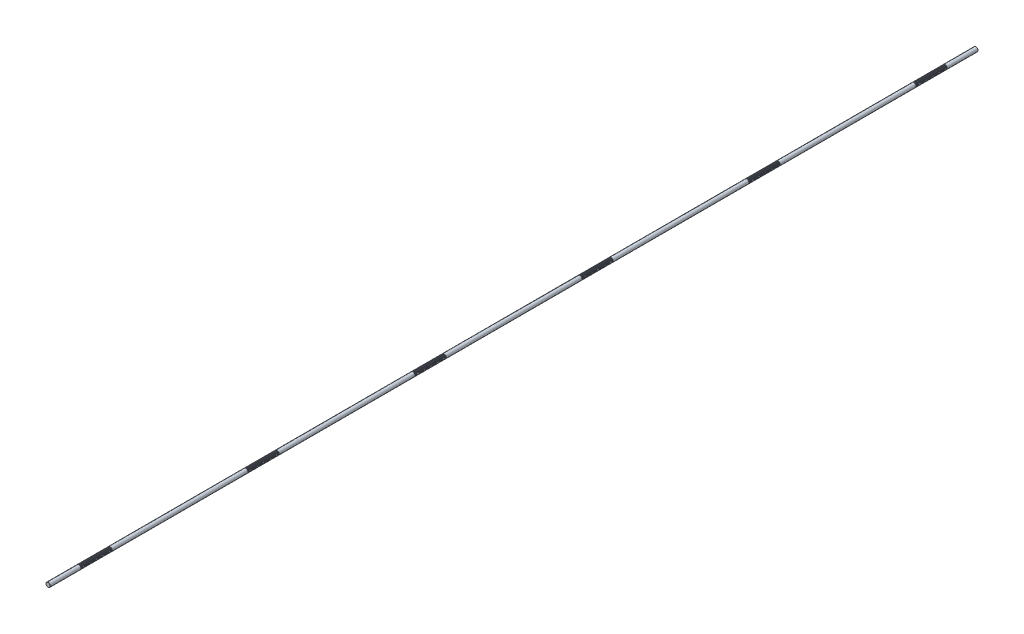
SolidWorks part; units mm, degrees
ref_plane "Front Plane" through (0, 0, 0) normal (0, 0, 1) x (1, 0, 0)
ref_plane "Top Plane" through (0, 0, 0) normal (0, 1, 0) x (1, 0, 0)
ref_plane "Right Plane" through (0, 0, 0) normal (1, 0, 0) x (0, 0, -1)
sketch "Sketch1" plane through (0, 0, 0) normal (0, 0, 1) x (1, 0, 0)
  circle A0 centre (0, 0) radius 7
  dimension "D1" = 14
extrude "Boss-Extrude1" add sketch "Sketch1" along normal mid plane 3000
chamfer "Chamfer1" distance 0.35 angle 45 2 edges at (7, 0, -1500) (7, 0, 1500)
sketch "Sketch2" plane through (0, 0, 0) normal (1, 0, 0) x (0, 0, -1)
  line L0 (1400.2345, 7) -> (1398.2655, 7)
  line L1 (1499.65, 7) -> (-1499.65, 7) construction
  line L2 (1398.2655, 7) -> (1398.7345, 5.25)
  line L3 (1398.7345, 5.25) -> (1399.7655, 5.25)
  line L4 (1399.7655, 5.25) -> (1400.2345, 7)
  line L5 (1500, -6.65) -> (1500, 6.65) construction
  point P4 (1399.25, 7)
  point P7 (1399.25, 5.25)
  point P8 (1400, 6.125)
  point P9 (1398.5, 6.125)
  dimension "D1" = 1.5
  dimension "D2" = 100
  dimension "D3" = 1.75
  dimension "D4" = 30
revolve "Cut-Revolve1" cut sketch "Sketch2" angle 360 about axis through (0, 0, 1500) along (0, 0, -1)
pattern_linear "LPattern1" count 34 spacing 3 along (0, 0, 1) of "Cut-Revolve1"
pattern_linear "LPattern2" count 6 spacing 540 along (0, 0, 1) of "Cut-Revolve1", "LPattern1"
